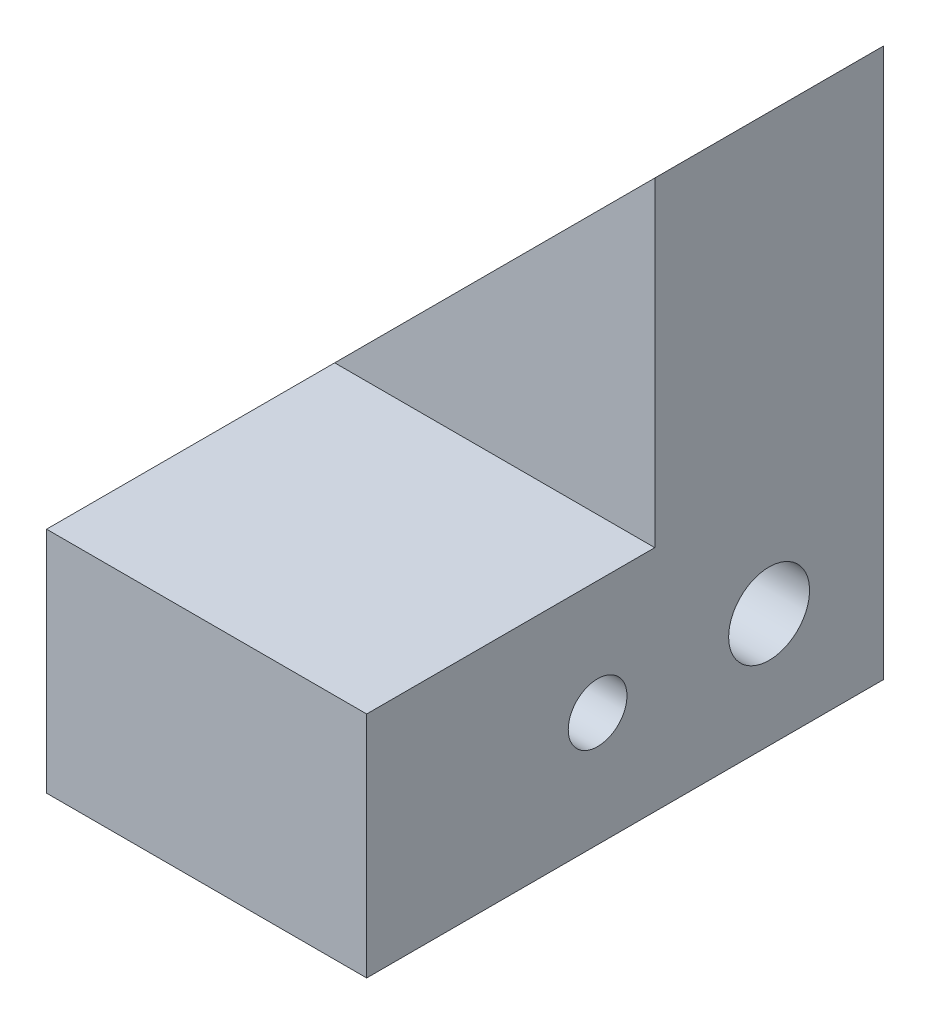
SolidWorks part; units mm, degrees
ref_plane "Front Plane" through (0, 0, 0) normal (0, 0, 1) x (1, 0, 0)
ref_plane "Top Plane" through (0, 0, 0) normal (0, 1, 0) x (1, 0, 0)
ref_plane "Right Plane" through (0, 0, 0) normal (1, 0, 0) x (0, 0, -1)
sketch "Sketch1" plane through (0, 0, 0) normal (0, 1, 0) x (1, 0, 0)
  line L1 (-30.4548, 16.5538) -> (-12.6748, 16.5538)
  line L2 (-30.4548, 16.5538) -> (-30.4548, -12.1482)
  line L3 (-30.4548, -12.1482) -> (-12.6748, -12.1482)
  line L4 (-12.6748, 16.5538) -> (-12.6748, -12.1482)
extrude "Boss-Extrude1" add sketch "Sketch1" along normal blind 30.48
sketch "Sketch2" plane through (-30.4548, 0, 0) normal (-1, 0, 0) x (0, 0, 1)
  line L0 (12.1482, 30.48) -> (12.1482, 0) construction
  line L1 (-16.5538, 0) -> (12.1482, 0)
  line L2 (-16.5538, 0) -> (-16.5538, 12.7)
  line L3 (-16.5538, 12.7) -> (12.1482, 12.7)
  line L4 (12.1482, 0) -> (12.1482, 12.7)
  line L5 (-16.5538, 30.48) -> (12.1482, 30.48) construction
  line L6 (-16.5538, 12.7) -> (-3.8538, 12.7)
  line L7 (-16.5538, 12.7) -> (-16.5538, 30.48)
  line L8 (-16.5538, 30.48) -> (-3.8538, 30.48)
  line L9 (-3.8538, 12.7) -> (-3.8538, 30.48)
extrude "Cut-Extrude1" cut sketch "Sketch2" against normal blind 30.48 contours L9 L3 M2 M3
sketch "Sketch3" plane through (0, 0, -3.8538) normal (0, 0, 1) x (1, 0, 0)
  line L0 (-30.4548, 12.7) -> (-12.5908, 30.564)
  line L1 (-12.6748, 12.7) -> (-30.4548, 12.7)
  line L2 (-30.4548, 12.7) -> (-30.4548, 30.48)
  line L3 (-30.4548, 30.48) -> (-12.5908, 30.564)
  line L4 (-30.4548, 12.7) -> (-30.4548, 30.48)
  line L5 (-30.4548, 30.48) -> (-12.5908, 30.564)
  arc A0 (-5.1913, 12.7) -> (-12.5908, 30.564) centre (-30.4548, 12.7) ccw
extrude "Cut-Extrude2" cut sketch "Sketch3" against normal blind 30.48 contours L0 M6 M5
hole_wizard "#30 (0.1285) Diameter Hole1" positions "Sketch4" profile "Sketch6" hole size "#30" standard "ANSI Inch"
sketch "Sketch4" plane through (-30.4548, 0, 0) normal (-1, 0, 0) x (0, 0, 1)
  line L0 (-16.5538, 12.7) -> (-16.5538, 0) construction
  line L1 (-3.8538, 12.7) -> (12.1482, 12.7) construction
  point P0 (-0.6788, 6.35)
  dimension "D1" = 15.875
  dimension "D2" = 6.35
sketch "Sketch6" plane through (-30.4548, 6.35, -0.6788) normal (0, 1, 0) x (0, 0, 1)
  line L0 (0, 0) -> (0, 17.78)
  line L1 (0, 17.78) -> (1.6319, 17.78)
  line L2 (1.6319, 17.78) -> (1.6319, 0)
  line L5 (1.6319, 0) -> (0, 0)
  line L11 (0, -6.35) -> (0, 107.95) construction
  dimension "Thru Hole Dia." = 3.2639
  dimension "Thru Hole Depth" = 17.78
hole_wizard "#16 (0.177) Diameter Hole1" positions "Sketch7" profile "Sketch8" hole size "#16" standard "ANSI Inch"
sketch "Sketch7" plane through (-30.4548, 0, 0) normal (-1, 0, 0) x (0, 0, 1)
  line L0 (-16.5538, 12.7) -> (-3.8538, 12.7) construction
  line L1 (-16.5538, 12.7) -> (-16.5538, 0) construction
  point P0 (-10.2038, 6.35)
  dimension "D1" = 6.35
  dimension "D2" = 6.35
sketch "Sketch8" plane through (-30.4548, 6.35, -10.2038) normal (0, 1, 0) x (0, 0, 1)
  line L0 (0, 0) -> (0, 17.78)
  line L1 (0, 17.78) -> (2.2479, 17.78)
  line L2 (2.2479, 17.78) -> (2.2479, 0)
  line L5 (2.2479, 0) -> (0, 0)
  line L11 (0, -6.35) -> (0, 107.95) construction
  dimension "Thru Hole Dia." = 4.4958
  dimension "Thru Hole Depth" = 17.78
